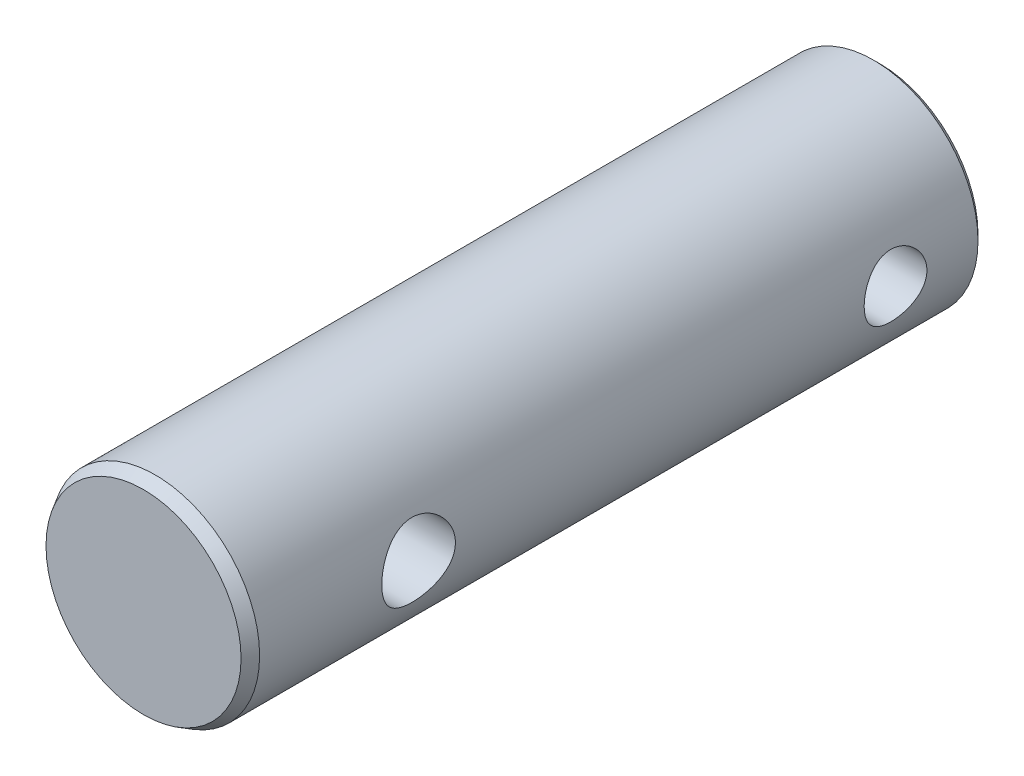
SolidWorks part; units mm, degrees
ref_plane "Front Plane" through (0, 0, 0) normal (0, 0, 1) x (1, 0, 0)
ref_plane "Top Plane" through (0, 0, 0) normal (0, 1, 0) x (1, 0, 0)
ref_plane "Right Plane" through (0, 0, 0) normal (1, 0, 0) x (0, 0, -1)
sketch "Sketch1" plane through (0, 0, 0) normal (1, 0, 0) x (0, 0, -1)
  line L0 (-15.212, 0) -> (21.3752, 0) construction
  line L1 (0, 4.5) -> (0, 2)
  line L2 (0, 2) -> (-10.16, 2)
  line L3 (-10.16, 2) -> (-11.3617, 0)
  line L4 (-11.3617, 0) -> (-31.75, 0)
  line L5 (-31.75, 0) -> (-31.75, 4.5)
  line L6 (-31.75, 4.5) -> (0, 4.5)
  line L11 (9.35, 4.6) -> (-19.1252, 4.6) construction
  line L12 (-5.7086, 0) -> (-5.7086, 4.6) construction
  line L13 (-1.9113, 0) -> (-1.9113, 5.9837) construction
  circle A0 centre (9.35, 0) radius 6.5 construction
  circle A1 centre (9.35, 6.5) radius 1.9 construction
  circle A2 centre (-3.81, 0) radius 1.8987 construction
  dimension "D8" = 13
  dimension "D9" = 3.8
  dimension "D11" = 3.7973
  dimension "D2" = 9
  dimension "D3" = 4
  dimension "D4" = 59
  dimension "D5" = 10.16
  dimension "D6" = 31.75
  dimension "D12" = 3.81
revolve "Revolve1" add sketch "Sketch1" angle 360 about L0
chamfer "Chamfer1" distance 0.508 angle 30 1 edges at (4.5, 0, 31.75)
sketch "Sketch2" plane through (0, 0, 0) normal (1, 0, 0) x (0, 0, -1)
  line L0 (-200015.212, 0) -> (200021.3752, 0) construction
  circle A0 centre (-3.81, 0) radius 1.8987 construction
  circle A1 centre (-3.81, 0) radius 1.3526
  dimension "D1" = 3.7973
  dimension "D3" = 2.7051
extrude "Cut-Extrude1" cut sketch "Sketch2" along normal through all
chamfer "Chamfer2" distance 0.254 angle 45 2 edges at (2, 0, 0) (4.5, 0, 0)
sketch "Sketch3" plane through (0, 0, 0) normal (1, 0, 0) x (0, 0, -1)
  line L0 (-31.75, 4.2067) -> (-31.75, -4.2067) construction
  circle A0 centre (-24.384, 0) radius 1.5875
  dimension "D1" = 3.175
  dimension "D2" = 7.366
extrude "Cut-Extrude2" cut sketch "Sketch3" against normal through all both and the other way through all
